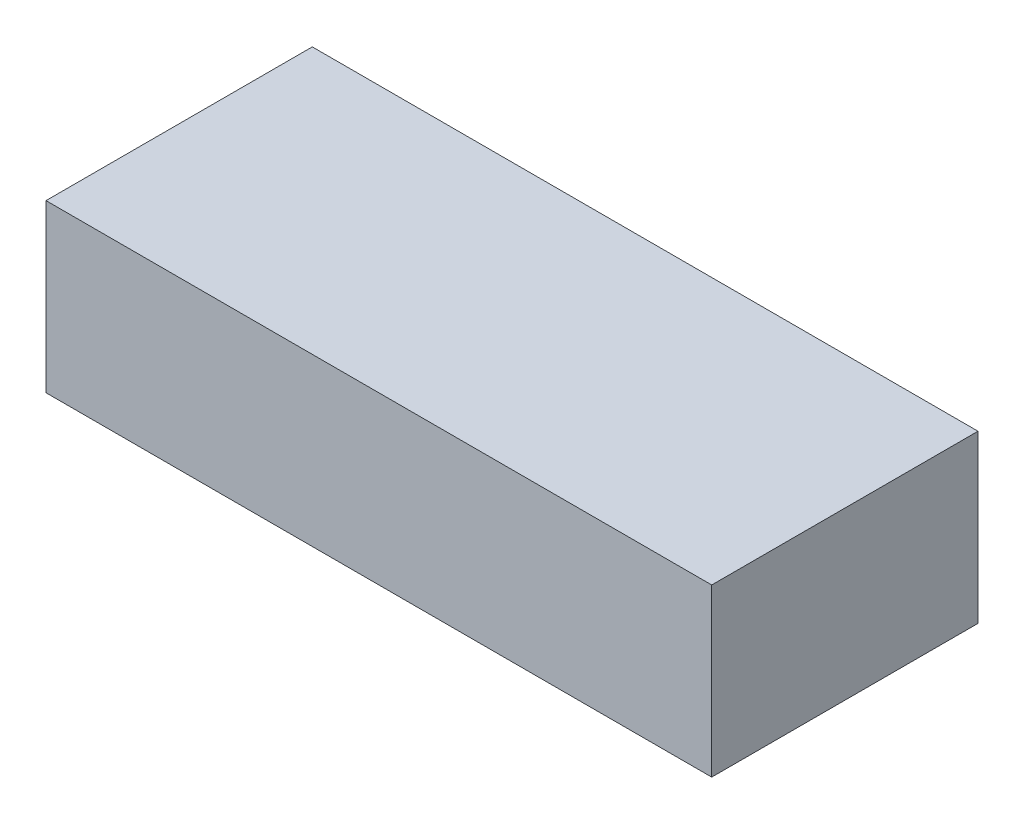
SolidWorks part; units mm, degrees
ref_plane "Plan de face" through (0, 0, 0) normal (0, 0, 1) x (1, 0, 0)
ref_plane "Plan de dessus" through (0, 0, 0) normal (0, 1, 0) x (1, 0, 0)
ref_plane "Plan de droite" through (0, 0, 0) normal (1, 0, 0) x (0, 0, -1)
sketch "Esquisse1" plane through (0, 0, 0) normal (0, 0, 1) x (1, 0, 0)
  line L1 (0, 0) -> (20, 0)
  line L2 (0, 0) -> (0, 5)
  line L3 (0, 5) -> (20, 5)
  line L4 (20, 0) -> (20, 5)
  dimension "D1" = 20
  dimension "D2" = 5
extrude "Extrusion1" add sketch "Esquisse1" along normal blind 8
